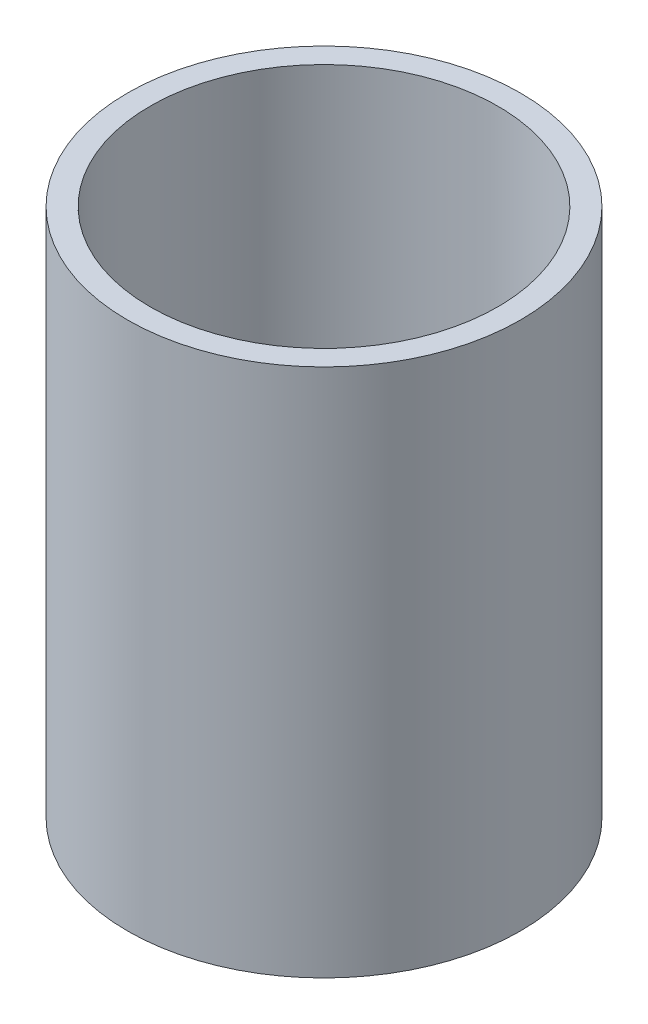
SolidWorks part; units mm, degrees
ref_plane "Front Plane" through (0, 0, 0) normal (0, 0, 1) x (1, 0, 0)
ref_plane "Top Plane" through (0, 0, 0) normal (0, 1, 0) x (1, 0, 0)
ref_plane "Right Plane" through (0, 0, 0) normal (1, 0, 0) x (0, 0, -1)
sketch "Sketch1" plane through (0, 0, 0) normal (0, 1, 0) x (1, 0, 0)
  circle A0 centre (0, 0) radius 26
  circle A1 centre (0, 0) radius 23
  dimension "D1" = 52
  dimension "D2" = 46
extrude "Boss-Extrude1" add sketch "Sketch1" along normal blind 70
